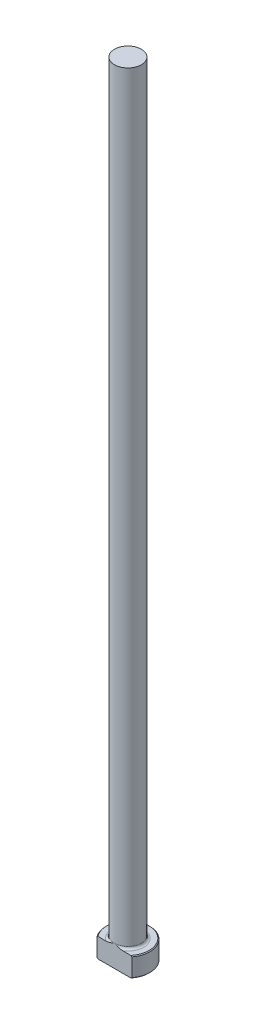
SolidWorks part; units mm, degrees
ref_plane "Front Plane" through (0, 0, 0) normal (0, 0, 1) x (1, 0, 0)
ref_plane "Top Plane" through (0, 0, 0) normal (0, 1, 0) x (1, 0, 0)
ref_plane "Right Plane" through (0, 0, 0) normal (1, 0, 0) x (0, 0, -1)
sketch "Sketch1" plane through (0, 0, 0) normal (0, 0, 1) x (1, 0, 0)
  line L0 (0, 259.9588) -> (0, -15.1925) construction
  line L1 (0, 0) -> (-7.1374, 0)
  line L2 (-7.1374, 0) -> (-7.1374, 6.35)
  line L3 (-7.1374, 6.35) -> (-4.365, 6.35)
  line L4 (-4.365, 6.35) -> (-4.365, 254)
  line L5 (-4.365, 254) -> (0, 254)
  line L6 (0, 254) -> (0, 0)
  dimension "L" = 254
  dimension "H" = 14.2748
  dimension "T" = 6.35
  dimension "D" = 8.73
revolve "Revolve1" add sketch "Sketch1" angle 360 about L0
chamfer "Chamfer1" distance 0.254 angle 45 2 edges at (0, 6.35, 7.1374) (0, 0, 7.1374)
fillet "Fillet1" radius 0.762 1 edges at (0, 6.35, 4.365)
sketch "Sketch2" plane through (0, 0, 0) normal (0, 1, 0) x (1, 0, 0)
  line L0 (-5.6471, -4.365) -> (5.6471, -4.365)
  circle A0 centre (0, 0) radius 7.1374 construction
  arc A1 (-5.6471, -4.365) -> (5.6471, -4.365) centre (0, 0) ccw
  circle A3 centre (0, 0) radius 4.365 construction
  dimension "D1" = 0
extrude "Key" cut sketch "Sketch2" along normal through all
sketch "Pocket Sketch" plane through (0, 0, 0) normal (0, 0, 1) x (1, 0, 0)
  line L0 (-7.5343, 0) -> (-7.5343, 6.3754)
  line L1 (-7.5343, 6.3754) -> (-5.5239, 6.3754)
  line L2 (-4.7619, 7.1374) -> (-4.7619, 22.225)
  line L3 (-4.7619, 22.225) -> (0, 22.225)
  line L4 (0, 22.225) -> (0, 0)
  line L5 (0, 0) -> (-7.5343, 0)
  line L6 (0, 12.6104) -> (0, -2.4989) construction
  line L7 (-7.1374, 6.096) -> (-7.1374, 0.254) construction
  line L8 (6.8834, 6.35) -> (-6.8834, 6.35) construction
  line L9 (-4.365, 254) -> (-4.365, 7.112) construction
  line L10 (-5.5239, 6.3754) -> (-4.7619, 7.1374)
  point P3 (-4.7619, 6.3754)
  dimension "D1" = 15.0685
  dimension "D2" = 0.3969
  dimension "D3" = 0.0254
  dimension "D4" = 0.3969
  dimension "D5" = 9.5237
  dimension "D6" = 22.225
